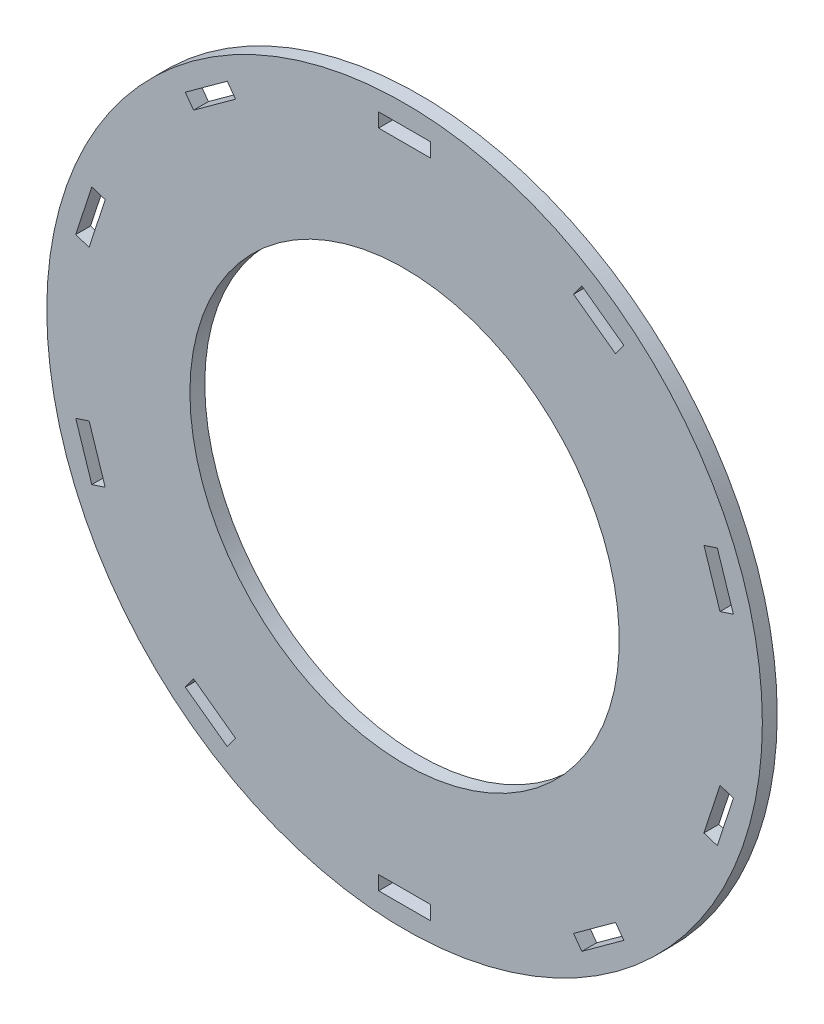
SolidWorks part; units mm, degrees
ref_plane "Front Plane" through (0, 0, 0) normal (0, 0, 1) x (1, 0, 0)
ref_plane "Top Plane" through (0, 0, 0) normal (0, 1, 0) x (1, 0, 0)
ref_plane "Right Plane" through (0, 0, 0) normal (1, 0, 0) x (0, 0, -1)
sketch "Sketch1" plane through (0, 0, 0) normal (0, 0, 1) x (1, 0, 0)
  line L0 (-4.715, 58.72) -> (-4.715, 61.28)
  line L5 (30.7002, 50.2769) -> (38.3293, 44.7341)
  line L6 (38.3293, 44.7341) -> (39.834, 46.8052)
  line L7 (-4.785, 58.65) -> (4.785, 58.65) construction
  line L8 (-4.785, 58.65) -> (-4.785, 61.35) construction
  line L9 (-4.785, 61.35) -> (4.785, 61.35) construction
  line L10 (4.785, 58.65) -> (4.785, 61.35) construction
  line L11 (-4.785, 58.65) -> (4.785, 61.35) construction
  line L12 (-4.785, 61.35) -> (4.785, 58.65) construction
  line L13 (-4.715, 61.28) -> (4.715, 61.28)
  line L14 (4.715, 58.72) -> (4.715, 61.28)
  line L15 (-4.715, 58.72) -> (4.715, 58.72)
  line L16 (32.205, 52.348) -> (39.834, 46.8052)
  line L17 (30.7002, 50.2769) -> (32.205, 52.348)
  line L18 (54.389, 22.6297) -> (57.3031, 13.6612)
  line L19 (57.3031, 13.6612) -> (59.7378, 14.4523)
  line L20 (56.8237, 23.4208) -> (59.7378, 14.4523)
  line L21 (54.389, 22.6297) -> (56.8237, 23.4208)
  line L22 (57.3031, -13.6612) -> (54.389, -22.6297)
  line L23 (54.389, -22.6297) -> (56.8237, -23.4208)
  line L24 (59.7378, -14.4523) -> (56.8237, -23.4208)
  line L25 (57.3031, -13.6612) -> (59.7378, -14.4523)
  line L26 (38.3293, -44.7341) -> (30.7002, -50.2769)
  line L27 (30.7002, -50.2769) -> (32.205, -52.348)
  line L28 (39.834, -46.8052) -> (32.205, -52.348)
  line L29 (38.3293, -44.7341) -> (39.834, -46.8052)
  line L30 (4.715, -58.72) -> (-4.715, -58.72)
  line L31 (-4.715, -58.72) -> (-4.715, -61.28)
  line L32 (4.715, -61.28) -> (-4.715, -61.28)
  line L33 (4.715, -58.72) -> (4.715, -61.28)
  line L34 (-30.7002, -50.2769) -> (-38.3293, -44.7341)
  line L35 (-38.3293, -44.7341) -> (-39.834, -46.8052)
  line L36 (-32.205, -52.348) -> (-39.834, -46.8052)
  line L37 (-30.7002, -50.2769) -> (-32.205, -52.348)
  line L38 (-54.389, -22.6297) -> (-57.3031, -13.6612)
  line L39 (-57.3031, -13.6612) -> (-59.7378, -14.4523)
  line L40 (-56.8237, -23.4208) -> (-59.7378, -14.4523)
  line L41 (-54.389, -22.6297) -> (-56.8237, -23.4208)
  line L42 (-57.3031, 13.6612) -> (-54.389, 22.6297)
  line L43 (-54.389, 22.6297) -> (-56.8237, 23.4208)
  line L44 (-59.7378, 14.4523) -> (-56.8237, 23.4208)
  line L45 (-57.3031, 13.6612) -> (-59.7378, 14.4523)
  line L46 (-38.3293, 44.7341) -> (-30.7002, 50.2769)
  line L47 (-30.7002, 50.2769) -> (-32.205, 52.348)
  line L48 (-39.834, 46.8052) -> (-32.205, 52.348)
  line L49 (-38.3293, 44.7341) -> (-39.834, 46.8052)
  circle A0 centre (0, 0) radius 65
  circle A1 centre (0, 0) radius 39
  point P0 (0, 0)
  point P5 (0, 60)
  point P52 (0, 0)
  point P73 (0, 0)
extrude "Boss-Extrude1" add sketch "Sketch1" along normal blind 2.7
equation "\"Thick\" = 2.7"
equation "\"h\"= 3"
equation "\"kerf\" = .14"
equation "\"Length\"= \"Thick\""
equation "\"Deflection\"= .4 * \"Thick\""
equation "\"Strain\"= \"Deflection\" / \"Length\""
equation "\"Per_def\"= 1.09 * ( \"Strain\" * \"Length\" * \"Length\" ) / \"h\""
equation "\"D1@Sketch1\"= 9.5 + \"kerf\" / 2"
equation "\"D2@Sketch1\"=\"Thick\""
equation "\"D5@Sketch1\"=\"kerf\"/2"
equation "\"D1@Boss-Extrude1\"=\"Thick\""
equation "\"circulo_ext\"=130"
equation "\"dist_corte_ext\"=60"
equation "\"D3@Sketch1\"=\"dist_corte_ext\""
equation "\"circulo_interno\"= \"circulo_ext\" - ( ( \"circulo_ext\" / 5 ) * 2 )"
equation "\"D7@Sketch1\"=\"circulo_interno\""
